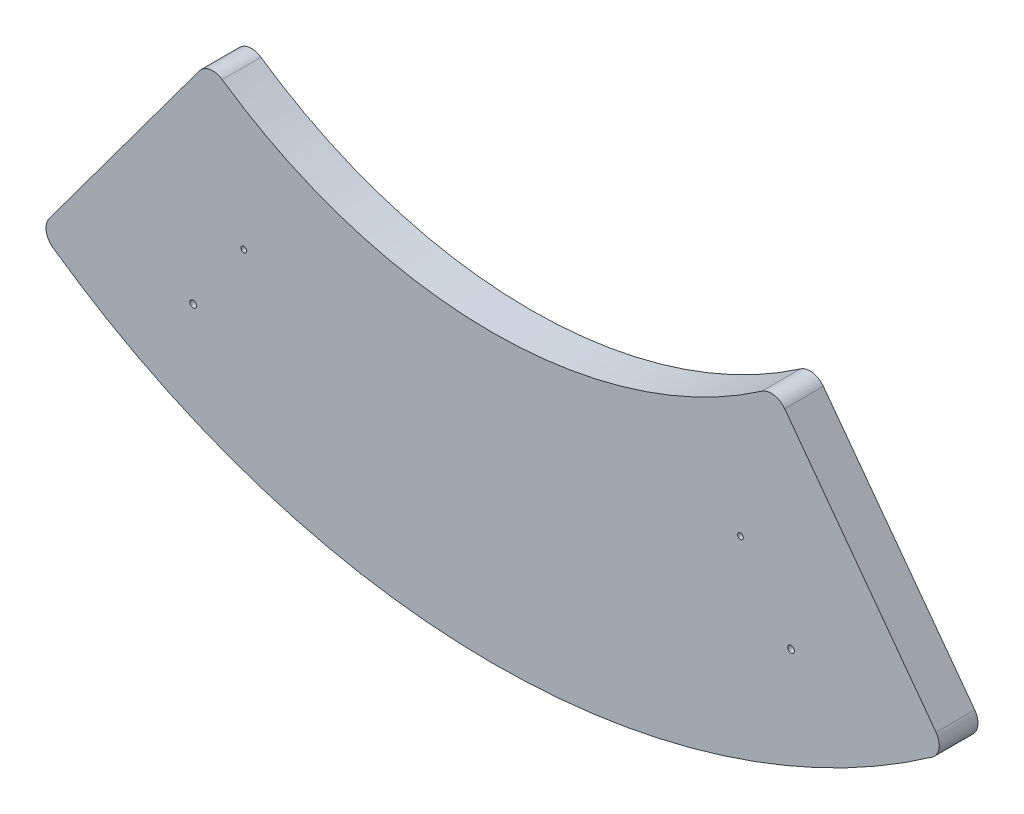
SolidWorks part; units mm, degrees
ref_plane "Plan de face" through (0, 0, 0) normal (0, 0, 1) x (1, 0, 0)
ref_plane "Plan de dessus" through (0, 0, 0) normal (0, 1, 0) x (1, 0, 0)
ref_plane "Plan de droite" through (0, 0, 0) normal (1, 0, 0) x (0, 0, -1)
sketch "Esquisse1" plane through (0, 0, 0) normal (0, 0, 1) x (1, 0, 0)
  line L0 (-256.9573, -308.9961) -> (-410.5325, -516.5412)
  line L1 (254.5903, -308.9961) -> (409.2442, -517.9989)
  line L2 (-256.9573, -308.9961) -> (-1.1835, 36.6623) construction
  line L3 (254.5903, -308.9961) -> (-1.1835, 36.6623) construction
  line L6 (67.4118, -440.6515) -> (-462.9307, -440.6515) construction
  line L7 (67.4118, -440.6515) -> (694.5833, -440.6515) construction
  line L8 (-1.1835, -393.3377) -> (-0.8841, -652.2104) construction
  arc A0 (-256.9573, -308.9961) -> (254.5903, -308.9961) centre (-1.1835, 36.6623) ccw
  circle A1 centre (-225.6289, -440.6515) radius 2.6
  arc A2 (409.2442, -517.9989) -> (-410.5325, -516.5412) centre (0.3429, 37.7885) cw
  circle A5 centre (223.3714, -440.6515) radius 2.6
  point P22 (0, 0)
  dimension "D1" = 430
  dimension "D2" = 260
  dimension "D5" = 224.5
  dimension "D9" = 5.2
  dimension "D3" = 73
  dimension "D6" = 224.5
extrude "Extrusion1" add sketch "Esquisse1" along normal blind 35
fillet "Congé1" radius 15 4 edges at (-256.9573, -308.9961, 17.5) (409.2442, -517.9989, 17.5) (254.5903, -308.9961, 17.5) (-410.5325, -516.5412, 17.5)
sketch "Esquisse2" plane through (0, 0, 35) normal (0, 0, 1) x (1, 0, 0)
  circle A0 centre (-271.3881, -506.2723) radius 3
  circle A1 centre (269.1305, -506.2723) radius 3
extrude "Enlèv. mat.-Extru.1" cut sketch "Esquisse2" against normal through all
